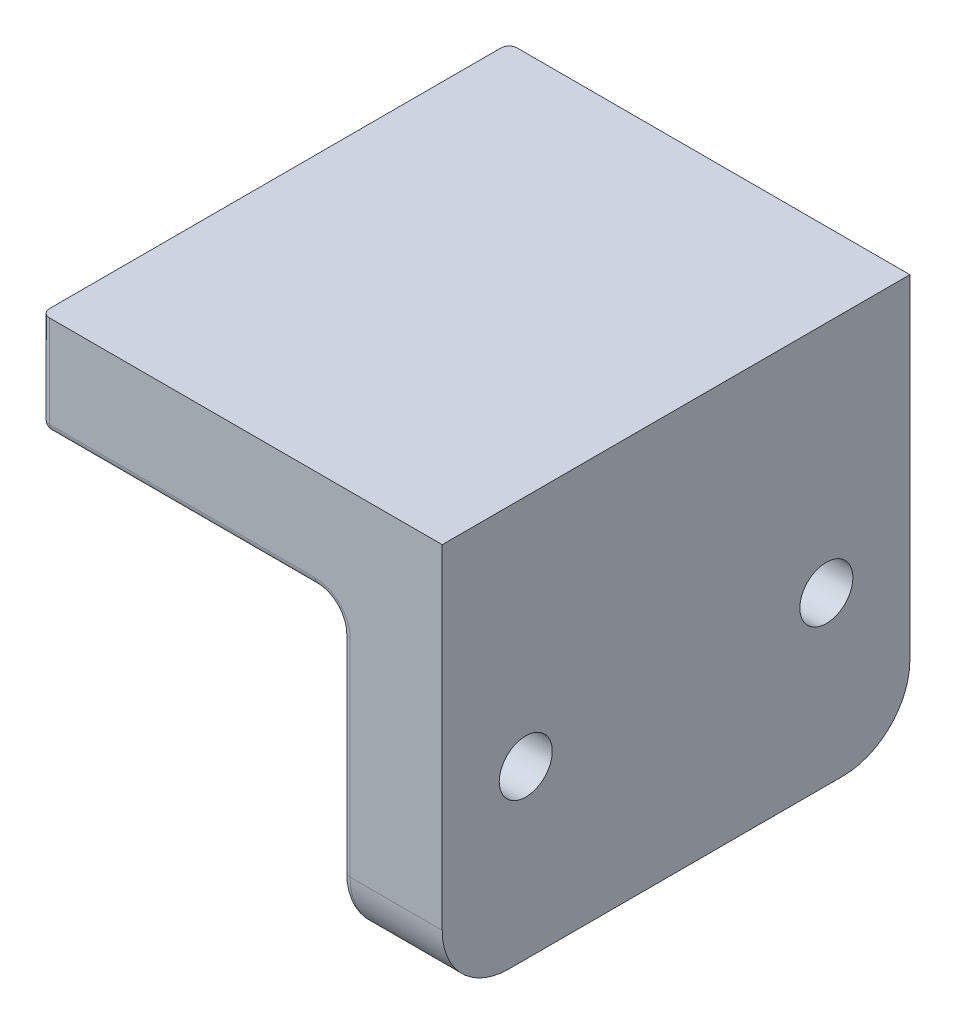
SolidWorks part; units mm, degrees
ref_plane "Front Plane" through (0, 0, 0) normal (0, 0, 1) x (1, 0, 0)
ref_plane "Top Plane" through (0, 0, 0) normal (0, 1, 0) x (1, 0, 0)
ref_plane "Right Plane" through (0, 0, 0) normal (1, 0, 0) x (0, 0, -1)
sketch "Sketch1" plane through (0, 0, 0) normal (0, 0, 1) x (1, 0, 0)
  line L2 (-76.2, 0) -> (-76.2, -19.05)
  line L3 (-76.2, -19.05) -> (-19.05, -19.05)
  line L5 (0, 0) -> (-76.2, 0)
  line L6 (0, 0) -> (0, -76.2)
  line L7 (0, -76.2) -> (-19.05, -76.2)
  line L8 (-19.05, -19.05) -> (-19.05, -76.2)
  dimension "D1" = 76.2
  dimension "D2" = 76.2
  dimension "D3" = 19.05
extrude "Extrude1" add sketch "Sketch1" along normal mid plane 88.9
fillet "Fillet1" radius 5.08 1 edges at (-19.05, -19.05, 0)
hole_wizard "CBORE for 3/8 Socket Head Cap Screw1" positions "Sketch3" profile "Sketch2" counterbore size "3/8" standard "Ansi Inch"
sketch "Sketch3" plane through (-19.05, 0, 0) normal (-1, 0, 0) x (0, 0, 1)
  line L0 (0, -76.2) -> (0, -38.9537) construction
  line L1 (44.45, -76.2) -> (-44.45, -76.2) construction
  line L2 (-44.45, -24.13) -> (-44.45, -76.2) construction
  point P0 (-28.575, -44.45)
  point P8 (28.575, -44.45)
  dimension "D1" = 15.875
  dimension "D2" = 31.75
sketch "Sketch2" plane through (-19.05, -44.45, -28.575) normal (0, 1, 0) x (0, 0, 1)
  line L0 (0, 0) -> (0, 19.05)
  line L1 (0, 19.05) -> (5.0419, 19.05)
  line L3 (5.0419, 19.05) -> (5.0419, 9.525)
  line L4 (5.0419, 9.525) -> (7.9375, 9.525)
  line L5 (7.9375, 9.525) -> (7.9375, 0)
  line L7 (7.9375, 0) -> (0, 0)
  line L11 (0, -6.35) -> (0, 107.95) construction
  dimension "Thru Hole Dia." = 10.0838
  dimension "Thru Hole Depth" = 19.05
  dimension "C'Bore Dia." = 15.875
  dimension "C'Bore Depth" = 9.525
fillet "Fillet2" radius 12.7 2 edges at (-9.525, -76.2, -44.45) (-9.525, -76.2, 44.45)
fillet "Fillet4" radius 0.762 6 edges at (-9.525, -44.45, 36.5125) (-9.525, -44.45, 33.6169) (-9.525, -44.45, -20.6375) (-9.525, -44.45, -23.5331) (-19.05, -44.45, 36.5125) (-19.05, -44.45, -20.6375)
sketch "Sketch4" plane through (0, -76.2, 0) normal (0, -1, 0) x (1, 0, 0)
  line L0 (-9.1712, -29.9329) -> (-9.1712, 15.4151) construction
  text T0 "<b>PART NUMBER 12345  MADE IN THE USA</b>" font "Century Gothic" height in points 10
extrude "Cut-Extrude1" cut sketch "Sketch4" against normal blind 0.762
fillet "Fillet5" radius 1.524 2 edges at (-76.2, -9.525, -44.45) (-76.2, -9.525, 44.45)
fillet "Fillet6" radius 1.524 12 edges at (-75.7536, -19.05, 44.0036) (-49.403, -19.05, 44.45) (-20.5379, -20.5379, 44.45) (-19.05, -43.815, 44.45) (-19.05, -72.4803, 40.7303) (-19.05, -76.2, 0) (-19.05, -72.4803, -40.7303) (-19.05, -43.815, -44.45) (-20.5379, -20.5379, -44.45) (-49.403, -19.05, -44.45) (-75.7536, -19.05, -44.0036) (-76.2, -19.05, 0)
